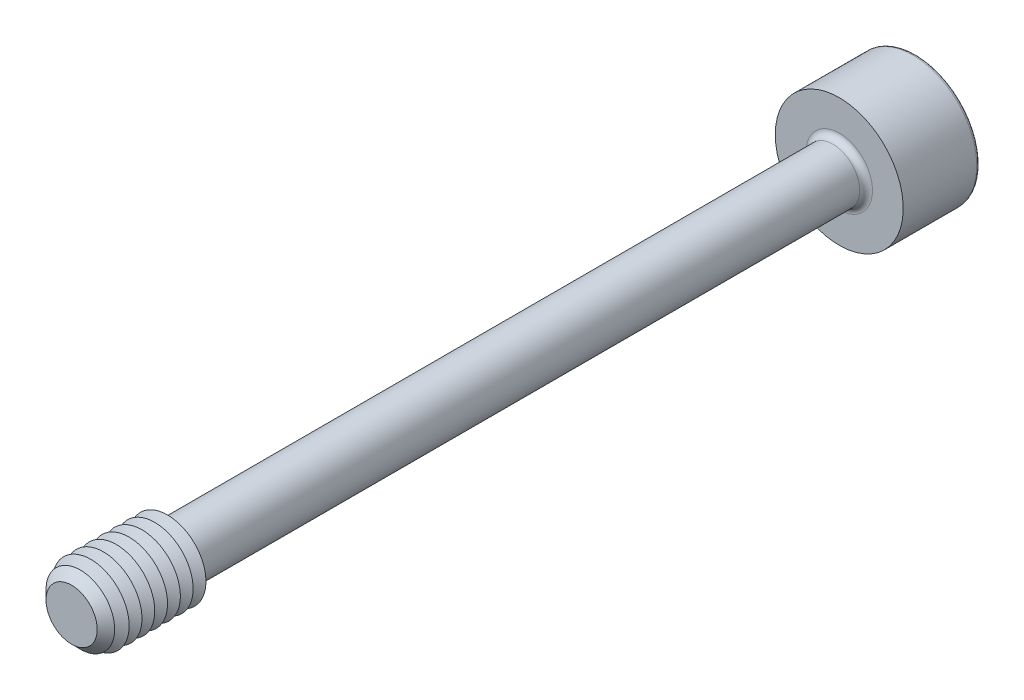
SolidWorks part; units mm, degrees
ref_plane "Front Plane" through (0, 0, 0) normal (0, 0, 1) x (1, 0, 0)
ref_plane "Top Plane" through (0, 0, 0) normal (0, 1, 0) x (1, 0, 0)
ref_plane "Right Plane" through (0, 0, 0) normal (1, 0, 0) x (0, 0, -1)
sketch "Sketch1" plane through (0, 0, 0) normal (0, 0, 1) x (1, 0, 0)
  circle A0 centre (0, 0) radius 2.1
  dimension "D1" = 4.2
extrude "Extrude1" add sketch "Sketch1" along normal mid plane 60
sketch "Sketch2" plane through (0, 0, 0) normal (1, 0, 0) x (0, 0, -1)
  line L0 (-30, 0) -> (-30, 3)
  line L1 (-30, 2.1) -> (-30, -2.1) construction
  line L2 (-30, 3) -> (-22.5, 3)
  line L3 (-22.5, 3) -> (-21.9804, 2.1)
  line L4 (30, 2.1) -> (-30, 2.1) construction
  line L5 (-21.9804, 2.1) -> (-21.9804, 0)
  line L6 (-21.9804, 0) -> (-30, 0)
  dimension "D1" = 3
  dimension "D2" = 120
  dimension "D3" = 7.5
revolve "Revolve1" add sketch "Sketch2" angle 360 about L6
chamfer "Chamfer1" distance 1 angle 45 1 edges at (0, 3, 30)
sketch "Sketch3" plane through (0, 0, -30) normal (0, 0, -1) x (-1, 0, 0)
  circle A0 centre (0, 0) radius 5
  dimension "D1" = 10
extrude "Extrude2" add sketch "Sketch3" along normal blind 6
sketch "Sketch4" plane through (-13.7, 0, -36) normal (0, 0, 1) x (1, 0, 0)
  line L2 (12.2566, -2.5) -> (15.1434, -2.5)
  line L3 (15.1434, -2.5) -> (16.5868, 0)
  line L4 (16.5868, 0) -> (15.1434, 2.5)
  line L6 (15.1434, 2.5) -> (12.2566, 2.5)
  line L7 (12.2566, 2.5) -> (10.8132, 0)
  line L8 (10.8132, 0) -> (12.2566, -2.5)
  circle A0 centre (13.7, 0) radius 2.5 construction
  dimension "D1" = 5
extrude "Extrude3" cut sketch "Sketch4" along normal blind 5
fillet "Fillet1" radius 0.5 1 edges at (-2.1, 0, -30)
fillet "Fillet2" radius 0.25 1 edges at (-5, 0, -36)
sketch "Sketch5" plane through (0, 0, 0) normal (1, 0, 0) x (0, 0, -1)
  line L0 (31, 0) -> (31, -2.5)
  line L1 (31, -2.5) -> (29.5566, 0)
  line L2 (29.5566, 0) -> (31, 0)
  dimension "D1" = 30
revolve "Cut-Revolve1" cut sketch "Sketch5" angle 360 about L2
sketch "Sketch6" plane through (0, 0, 0) normal (1, 0, 0) x (0, 0, -1)
  line L0 (1.332, 0) -> (-13.289, 0) construction
sketch "Sketch7" plane through (0, 0, 0) normal (1, 0, 0) x (0, 0, -1)
  line L0 (-22.5, 3) -> (-23, 2.134)
  line L1 (-23, 2.134) -> (-23.5, 3)
  line L2 (-22.5, 3) -> (-29, 3) construction
  line L3 (-23.5, 3) -> (-22.5, 3)
  dimension "D1" = 1
revolve "Cut-Revolve2" cut sketch "Sketch7" angle 360 about L0
pattern_linear "LPattern1" count 7 spacing 1 along (0, 0, 1) of "Cut-Revolve2"
